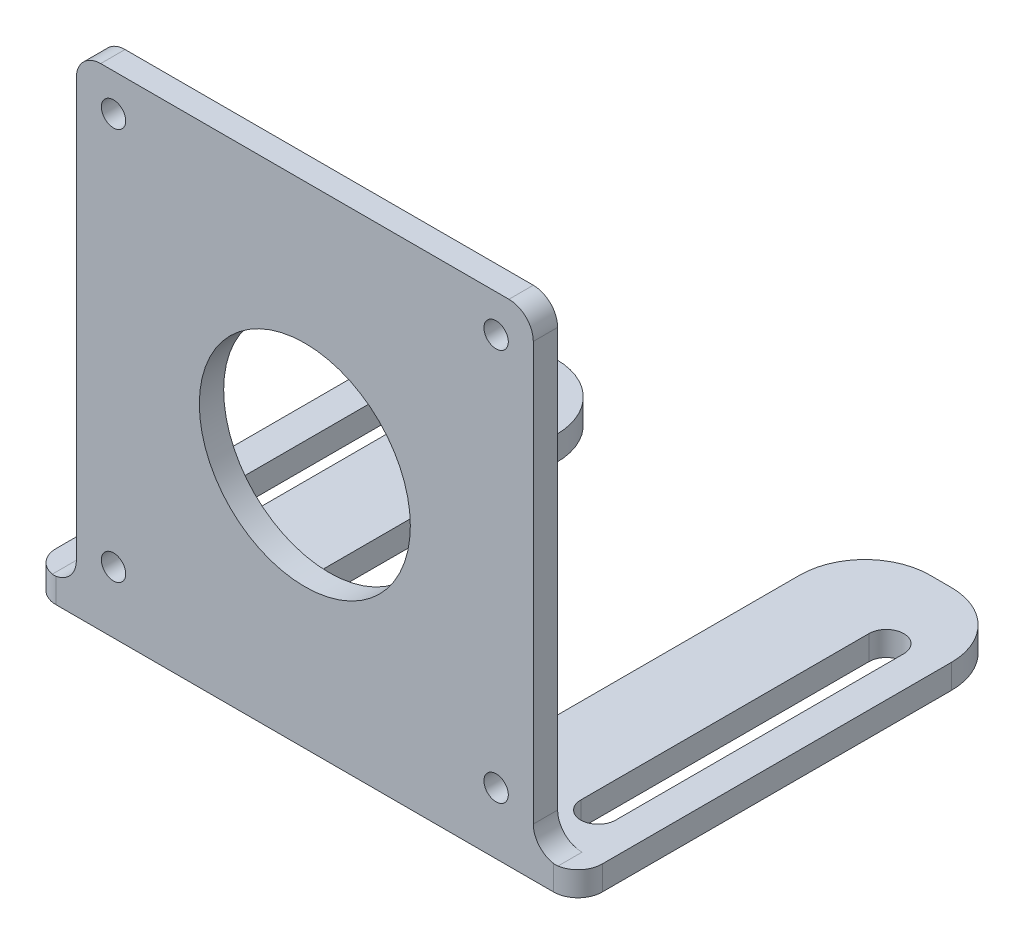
SolidWorks part; units mm, degrees
ref_plane "Plan de face" through (0, 0, 0) normal (0, 0, 1) x (1, 0, 0)
ref_plane "Plan de dessus" through (0, 0, 0) normal (0, 1, 0) x (1, 0, 0)
ref_plane "Plan de droite" through (0, 0, 0) normal (1, 0, 0) x (0, 0, -1)
sketch "Esquisse1" plane through (0, 0, 0) normal (0, 0, 1) x (1, 0, 0)
  line L0 (-28.15, -30.25) -> (-28.15, 30.25)
  line L1 (28.15, -30.25) -> (28.15, 30.25)
  line L3 (-28.15, -30.25) -> (28.15, -30.25)
  line L4 (28.15, 30.25) -> (-28.15, 30.25)
  circle A0 centre (0, 0) radius 13
  dimension "D23" = 26
  dimension "D3" = 30.25
  dimension "D7" = 28.15
  dimension "D8" = 56.3
  dimension "D17" = 60.5
extrude "Boss.-Extru.1" add sketch "Esquisse1" along normal blind 3
sketch "Esquisse2" plane through (0, 0, 0) normal (0, 0, -1) x (-1, 0, 0)
  line L2 (28.15, 30.25) -> (28.15, -30.25) construction
  line L3 (-28.15, -30.25) -> (28.15, -30.25)
  line L4 (-28.15, -30.25) -> (-28.15, -27.25)
  line L5 (-28.15, -27.25) -> (28.15, -27.25)
  line L10 (28.15, -30.25) -> (28.15, -27.25)
  dimension "D1" = 3
extrude "Boss.-Extru.3" add sketch "Esquisse2" along normal blind 51 and the other way blind 3
sketch "Esquisse7" plane through (-28.15, 0, 0) normal (-1, 0, 0) x (0, 0, 1)
  line L1 (-51, -27.25) -> (3, -27.25)
  line L2 (-51, -27.25) -> (-51, -30.25)
  line L3 (-51, -30.25) -> (3, -30.25)
  line L4 (3, -27.25) -> (3, -30.25)
extrude "Boss.-Extru.4" add sketch "Esquisse7" along normal blind 5.5
sketch "Esquisse8" plane through (28.15, 0, 0) normal (1, 0, 0) x (0, 0, -1)
  line L1 (51, -30.25) -> (-3, -30.25)
  line L2 (51, -30.25) -> (51, -27.25)
  line L3 (51, -27.25) -> (-3, -27.25)
  line L4 (-3, -30.25) -> (-3, -27.25)
extrude "Boss.-Extru.5" add sketch "Esquisse8" along normal blind 5.5
sketch "Esquisse6" plane through (0, -27.25, 0) normal (0, 1, 0) x (1, 0, 0)
  line L0 (27.65, 5.5) -> (27.65, 41) construction
  line L1 (25.5, 5.5) -> (25.5, 41)
  line L2 (29.8, 5.5) -> (29.8, 41)
  line L3 (-27.65, 5.5) -> (-27.65, 41) construction
  line L4 (-29.8, 5.5) -> (-29.8, 41)
  line L5 (-25.5, 5.5) -> (-25.5, 41)
  line L7 (33.65, 51) -> (-33.65, 51) construction
  line L12 (33.65, 51) -> (33.65, -3) construction
  line L13 (-33.65, -3) -> (-33.65, 51) construction
  arc A0 (25.5, 5.5) -> (29.8, 5.5) centre (27.65, 5.5) ccw
  arc A1 (29.8, 41) -> (25.5, 41) centre (27.65, 41) ccw
  arc A2 (-29.8, 5.5) -> (-25.5, 5.5) centre (-27.65, 5.5) ccw
  arc A3 (-25.5, 41) -> (-29.8, 41) centre (-27.65, 41) ccw
  point P2 (27.65, 23.25)
  point P7 (-27.65, 23.25)
  dimension "D1" = 4.3
  dimension "D2" = 4.3
  dimension "D3" = 6
  dimension "D4" = 6
  dimension "D5" = 35.5
  dimension "D6" = 35.5
  dimension "D7" = 10
  dimension "D8" = 10
extrude "Enlèv. mat.-Extru.2" cut sketch "Esquisse6" against normal blind 51
fillet "Congé2" radius 3 2 edges at (33.65, -28.75, 3) (-33.65, -28.75, 3)
fillet "Congé3" radius 8 2 edges at (33.65, -28.75, -51) (-33.65, -28.75, -51)
sketch "Esquisse9" plane through (0, -27.25, 0) normal (0, 1, 0) x (1, 0, 0)
  line L0 (0, 0) -> (0, 52.5913) construction
  line L1 (28.15, 0) -> (-28.15, 0) construction
  line L2 (-15, 54.1635) -> (15, 54.1635)
  line L3 (-15, 54.1635) -> (-15, 8)
  line L4 (-15, 8) -> (15, 8)
  line L5 (15, 54.1635) -> (15, 8)
  dimension "D1" = 8
  dimension "D2" = 15
  dimension "D3" = 15
extrude "Enlèv. mat.-Extru.3" cut sketch "Esquisse9" against normal through all
fillet "Congé4" radius 5 2 edges at (15, -28.75, -8) (-15, -28.75, -8)
sketch "Esquisse10" plane through (0, 0, 0) normal (0, 0, -1) x (-1, 0, 0)
  line L0 (-28.15, -27.25) -> (-28.15, 30.25) construction
  line L1 (-30.1146, 30.25) -> (-23.65, 30.25)
  line L2 (-30.1146, 30.25) -> (-30.1146, -27.25)
  line L3 (-30.1146, -27.25) -> (-23.65, -27.25)
  line L4 (-23.65, 30.25) -> (-23.65, -27.25)
  line L5 (23.65, 30.25) -> (31.9237, 30.25)
  line L6 (23.65, 30.25) -> (23.65, -27.25)
  line L7 (23.65, -27.25) -> (31.9237, -27.25)
  line L8 (31.9237, 30.25) -> (31.9237, -27.25)
  line L9 (28.15, 30.25) -> (28.15, -27.25) construction
  line L10 (-25.65, -27.25) -> (-33.65, -27.25) construction
  line L11 (-28.15, 30.25) -> (28.15, 30.25) construction
  dimension "D1" = 4.5
  dimension "D2" = 4.5
extrude "Enlèv. mat.-Extru.4" cut sketch "Esquisse10" against normal through all
fillet "Congé7" radius 8 2 edges at (-15, -28.75, -51) (15, -28.75, -51)
sketch "Esquisse11" plane through (-23.65, 0, 0) normal (-1, 0, 0) x (0, 0, 1)
  line L1 (0, 30.25) -> (3, 30.25)
  line L2 (0, 30.25) -> (0, -27.25)
  line L3 (0, -27.25) -> (3, -27.25)
  line L4 (3, 30.25) -> (3, -27.25)
extrude "Boss.-Extru.6" add sketch "Esquisse11" along normal blind 4.5
sketch "Esquisse12" plane through (23.65, 0, 0) normal (1, 0, 0) x (0, 0, -1)
  line L1 (-3, 30.25) -> (0, 30.25)
  line L2 (-3, 30.25) -> (-3, -27.25)
  line L3 (-3, -27.25) -> (0, -27.25)
  line L4 (0, 30.25) -> (0, -27.25)
extrude "Boss.-Extru.7" add sketch "Esquisse12" along normal blind 4.5
sketch "Esquisse13" plane through (0, 0, 0) normal (0, 0, -1) x (-1, 0, 0)
  line L0 (-28.15, -27.25) -> (-28.15, 30.25) construction
  line L1 (28.15, 30.25) -> (28.15, -27.25) construction
  line L2 (-28.15, 30.25) -> (28.15, 30.25) construction
  line L3 (28.15, -27.25) -> (-28.15, -27.25) construction
  circle A0 centre (-23.57, 25.67) radius 1.5
  circle A1 centre (23.57, 25.67) radius 1.5
  circle A2 centre (23.57, -22.67) radius 1.5
  circle A3 centre (-23.57, -22.67) radius 1.5
  dimension "D2" = 3
  dimension "D3" = 3
  dimension "D4" = 3
  dimension "D5" = 3
  dimension "D1" = 4.58
  dimension "D6" = 4.58
  dimension "D7" = 4.58
  dimension "D8" = 4.58
extrude "Enlèv. mat.-Extru.5" cut sketch "Esquisse13" against normal through all
fillet "Congé8" radius 3 4 edges at (-28.15, -27.25, 1.5) (28.15, -27.25, 1.5) (28.15, 30.25, 1.5) (-28.15, 30.25, 1.5)
